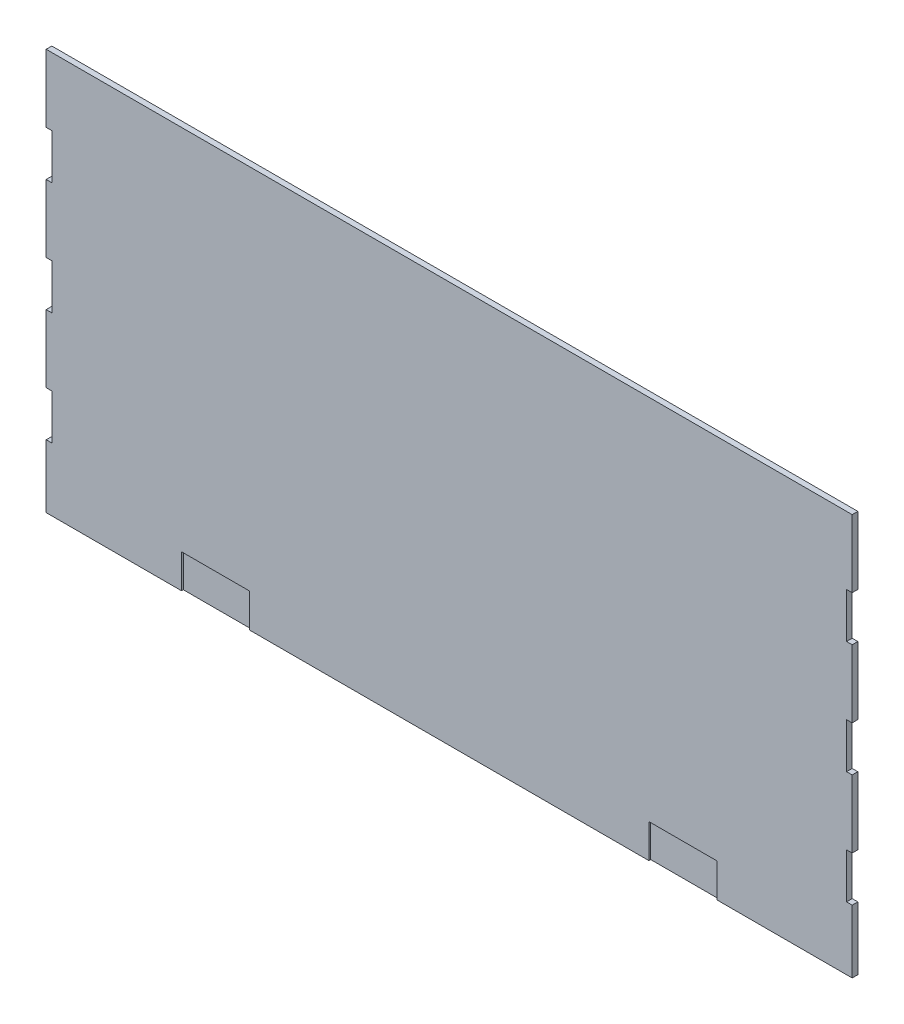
SolidWorks part; units mm, degrees
ref_plane "Front Plane" through (0, 0, 0) normal (0, 0, 1) x (1, 0, 0)
ref_plane "Top Plane" through (0, 0, 0) normal (0, 1, 0) x (1, 0, 0)
ref_plane "Right Plane" through (0, 0, 0) normal (1, 0, 0) x (0, 0, -1)
sketch "Sketch1" plane through (0, 0, 0) normal (0, 0, 1) x (1, 0, 0)
  line L0 (0, 226.06) -> (0, 187.96) construction
  line L1 (0, 0) -> (454.025, 0)
  line L2 (0, 0) -> (0, 35.56)
  line L3 (0, 226.06) -> (454.025, 226.06)
  line L5 (0, 187.96) -> (3.175, 187.96)
  line L6 (3.175, 187.96) -> (3.175, 162.56)
  line L7 (3.175, 162.56) -> (0, 162.56)
  line L8 (0, 162.56) -> (0, 124.46) construction
  line L9 (0, 124.46) -> (3.175, 124.46)
  line L10 (3.175, 124.46) -> (3.175, 99.06)
  line L11 (3.175, 99.06) -> (0, 99.06)
  line L12 (0, 99.06) -> (0, 60.96) construction
  line L13 (0, 60.96) -> (3.175, 60.96)
  line L14 (3.175, 60.96) -> (3.175, 35.56)
  line L15 (3.175, 35.56) -> (0, 35.56)
  line L16 (0, 187.96) -> (0, 226.06)
  line L17 (0, 124.46) -> (0, 162.56)
  line L18 (0, 60.96) -> (0, 99.06)
  line L19 (227.0125, 226.06) -> (227.0125, -50.8411) construction
  line L20 (454.025, 99.06) -> (454.025, 60.96) construction
  line L21 (454.025, 162.56) -> (454.025, 124.46) construction
  line L22 (454.025, 226.06) -> (454.025, 187.96) construction
  line L23 (454.025, 60.96) -> (454.025, 99.06)
  line L24 (454.025, 124.46) -> (454.025, 162.56)
  line L25 (454.025, 187.96) -> (454.025, 226.06)
  line L26 (450.85, 35.56) -> (454.025, 35.56)
  line L27 (450.85, 60.96) -> (450.85, 35.56)
  line L28 (454.025, 60.96) -> (450.85, 60.96)
  line L29 (450.85, 99.06) -> (454.025, 99.06)
  line L30 (450.85, 124.46) -> (450.85, 99.06)
  line L31 (454.025, 124.46) -> (450.85, 124.46)
  line L32 (450.85, 162.56) -> (454.025, 162.56)
  line L33 (450.85, 187.96) -> (450.85, 162.56)
  line L34 (454.025, 187.96) -> (450.85, 187.96)
  line L35 (454.025, 0) -> (454.025, 35.56)
  dimension "D1" = 226.06
  dimension "D2" = 454.025
  dimension "D3" = 25.4
  dimension "D4" = 3.175
  dimension "D5" = 38.1
extrude "Boss-Extrude1" add sketch "Sketch1" along normal blind 3.175
sketch "Sketch2" plane through (0, 0, 3.175) normal (0, 0, 1) x (1, 0, 0)
  line L0 (0, 0) -> (76.2, 0) construction
  line L1 (0, 0) -> (454.025, 0) construction
  line L2 (76.2, 0) -> (76.2, 19.05)
  line L3 (76.2, 19.05) -> (114.554, 19.05)
  line L4 (114.554, 19.05) -> (114.554, 0)
  line L5 (114.554, 0) -> (76.2, 0)
  line L6 (227.0125, 226.06) -> (227.0125, -19.2613) construction
  line L7 (454.025, 226.06) -> (0, 226.06) construction
  line L8 (339.471, 0) -> (377.825, 0)
  line L9 (339.471, 19.05) -> (339.471, 0)
  line L10 (377.825, 19.05) -> (339.471, 19.05)
  line L11 (377.825, 0) -> (377.825, 19.05)
  dimension "D1" = 76.2
  dimension "D2" = 38.354
  dimension "D3" = 19.05
extrude "Cut-Extrude1" cut sketch "Sketch2" against normal blind 1.016
